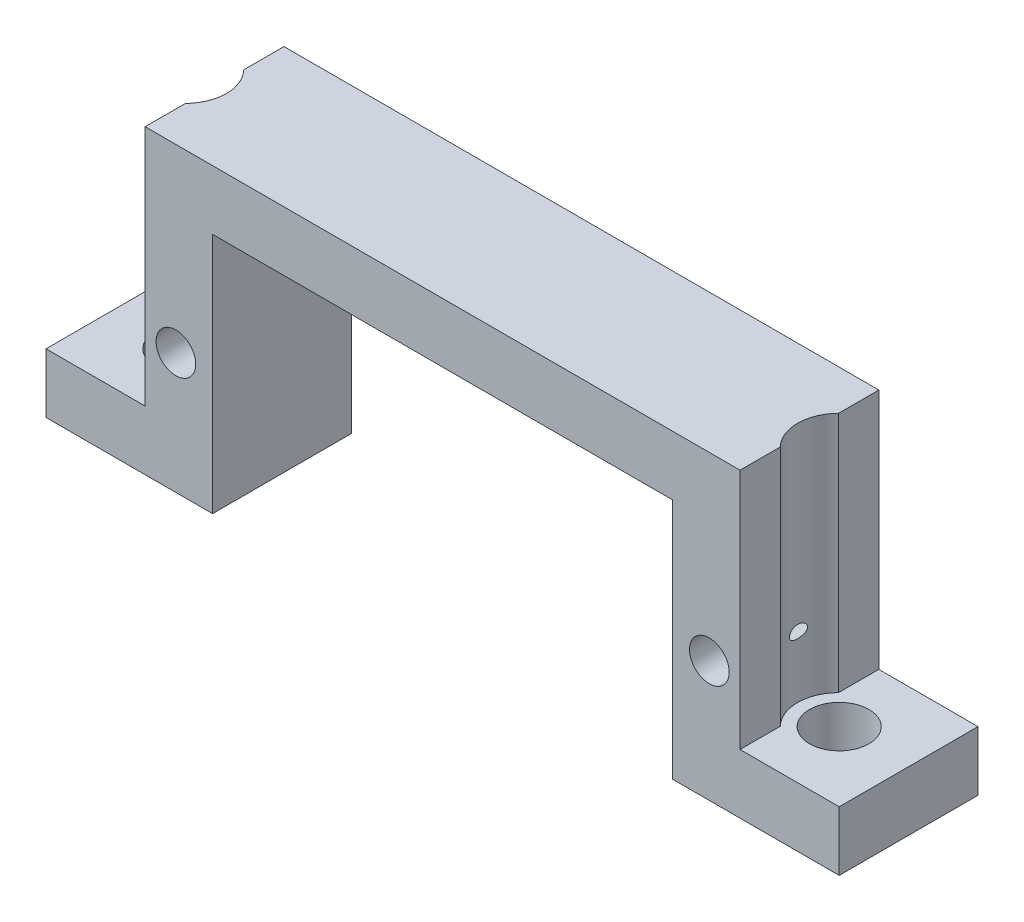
SolidWorks part; units mm, degrees
ref_plane "Plan de face" through (0, 0, 0) normal (0, 0, 1) x (1, 0, 0)
ref_plane "Plan de dessus" through (0, 0, 0) normal (0, 1, 0) x (1, 0, 0)
ref_plane "Plan de droite" through (0, 0, 0) normal (1, 0, 0) x (0, 0, -1)
sketch "Esquisse1" plane through (0, 0, 0) normal (0, 0, 1) x (1, 0, 0)
  line L0 (0, -12.4775) -> (0, 12.2) construction
  line L1 (-36.2903, 0) -> (44.6751, 0) construction
  line L2 (11.6, -12.4775) -> (11.6, 19.1396) construction
  line L3 (38.0003, 3) -> (6.9483, 3) construction
  line L4 (15, -12.4775) -> (15, 18.4775) construction
  line L5 (44.6751, 12.2) -> (-6.4011, 12.2) construction
  line L6 (44.6751, 15.2) -> (-6.4011, 15.2) construction
  line L8 (20, -12.4775) -> (20, 5.3598) construction
  line L9 (11.6, 0) -> (20, 0)
  line L10 (20, 0) -> (20, 3)
  line L11 (20, 3) -> (15, 3)
  line L12 (15, 3) -> (15, 15.2)
  line L13 (11.6, 0) -> (11.6, 12.2)
  line L14 (-11.6, 0) -> (-11.6, 12.2)
  line L15 (-15, 3) -> (-15, 15.2)
  line L16 (-20, 3) -> (-15, 3)
  line L17 (-20, 0) -> (-20, 3)
  line L18 (-11.6, 0) -> (-20, 0)
  line L19 (11.6, 12.2) -> (-11.6, 12.2)
  line L20 (15, 15.2) -> (-15, 15.2)
  line L21 (5.5789, 6.1) -> (14.9987, 6.1) construction
  line L22 (13.45, 19.1396) -> (13.45, 3.9366) construction
  circle A0 centre (13.45, 6.1) radius 1
  circle A1 centre (-13.45, 6.1) radius 1
  dimension "D1" = 3
  dimension "D2" = 11.6
  dimension "D3" = 3.4
  dimension "D4" = 3
  dimension "D5" = 12.2
  dimension "D6" = 5
  dimension "D8" = 6.1
  dimension "D9" = 1.85
extrude "Boss.-Extru.1" add sketch "Esquisse1" along normal blind 7
sketch "Esquisse2" plane through (0, 3, 0) normal (0, 1, 0) x (1, 0, 0)
  line L0 (0, 10.6841) -> (0, -13.1676) construction
  line L1 (20, -3.5) -> (12.172, -3.5) construction
  line L2 (16.5, 8.2223) -> (16.5, -4.1412) construction
  line L3 (20, -7) -> (20, 0) construction
  circle A0 centre (16.5, -3.5) radius 1.5
  circle A1 centre (-16.5, -3.5) radius 1.5
  dimension "D1" = 3.5
extrude "Enlèv. mat.-Extru.1" cut sketch "Esquisse2" against normal blind 3
sketch "Esquisse3" plane through (0, 15.2, 0) normal (0, 1, 0) x (1, 0, 0)
  line L0 (0, 7.5494) -> (0, -3.5) construction
  circle A0 centre (16.5, -3.5) radius 2.1
  circle A2 centre (-16.5, -3.5) radius 2.1
extrude "Enlèv. mat.-Extru.2" cut sketch "Esquisse3" against normal blind 12.2
